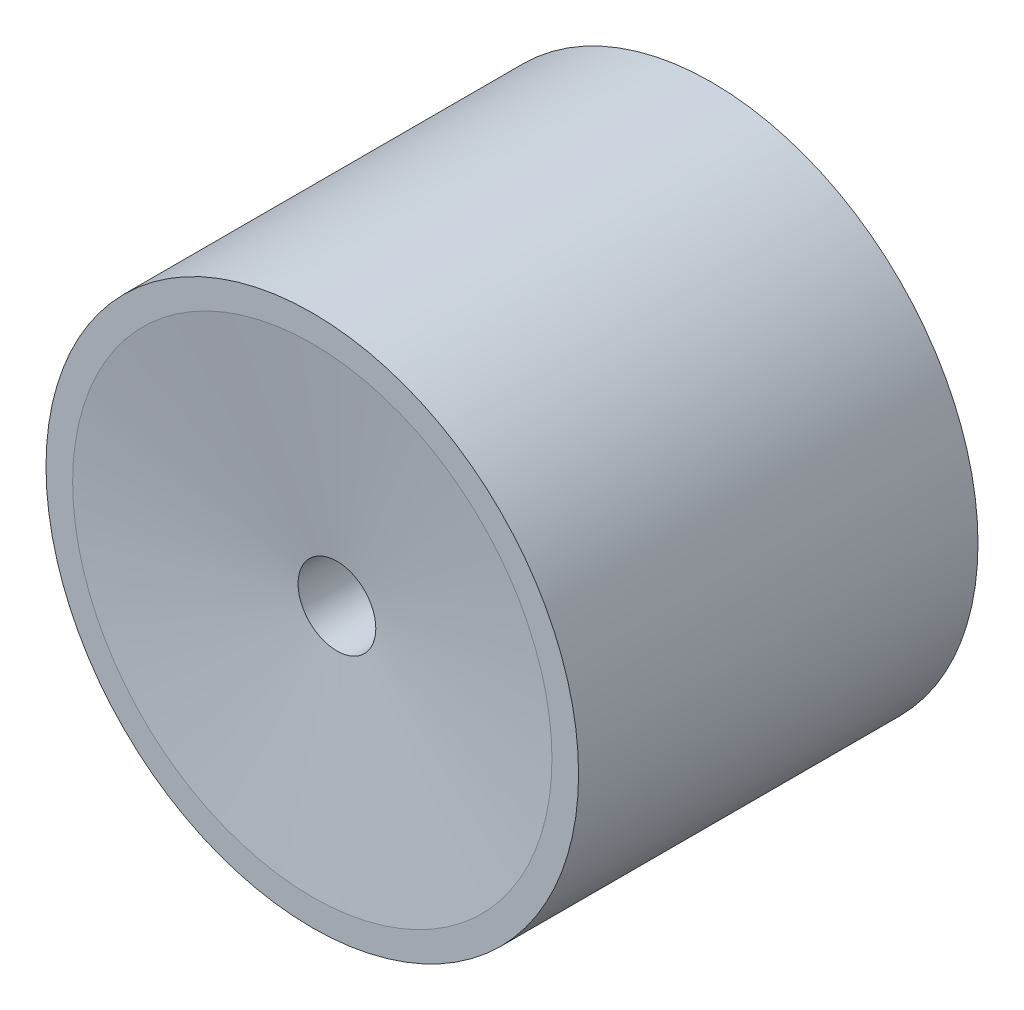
SolidWorks part; units mm, degrees
ref_plane "Plan de face" through (0, 0, 0) normal (0, 0, 1) x (1, 0, 0)
ref_plane "Plan de dessus" through (0, 0, 0) normal (0, 1, 0) x (1, 0, 0)
ref_plane "Plan de droite" through (0, 0, 0) normal (1, 0, 0) x (0, 0, -1)
sketch "Esquisse1" plane through (0, 0, 0) normal (0, 0, 1) x (1, 0, 0)
  circle A0 centre (0, 0) radius 10
  dimension "D1" = 20
extrude "Boss.-Extru.1" add sketch "Esquisse1" along normal blind 15
sketch "Esquisse2" plane through (0, 0, 0) normal (0, 0, 1) x (1, 0, 0)
  circle A0 centre (0, 0) radius 3.4
  dimension "D1" = 6.8
extrude "Enlèv. mat.-Extru.1" cut sketch "Esquisse2" along normal blind 8
sketch "Esquisse3" plane through (0, 0, 8) normal (0, 0, -1) x (-1, 0, 0)
  circle A0 centre (0, 0) radius 1.2
  dimension "D1" = 2.4
extrude "Enlèv. mat.-Extru.2" cut sketch "Esquisse3" against normal through all draft 2.45
sketch "Esquisse5" plane through (0, 0, 15) normal (0, 0, 1) x (1, 0, 0)
  circle A0 centre (0, 0) radius 9
  dimension "D1" = 18
extrude "Enlèv. mat.-Extru.3" cut sketch "Esquisse5" against normal blind 1 draft 83
sketch "Esquisse6" plane through (0, 0, 0) normal (0, 0, -1) x (-1, 0, 0)
  circle A0 centre (0, 0) radius 9
  circle A1 centre (0, 0) radius 5.5
  dimension "D1" = 18
  dimension "D2" = 11
extrude "Enlèv. mat.-Extru.4" cut sketch "Esquisse6" against normal blind 13
